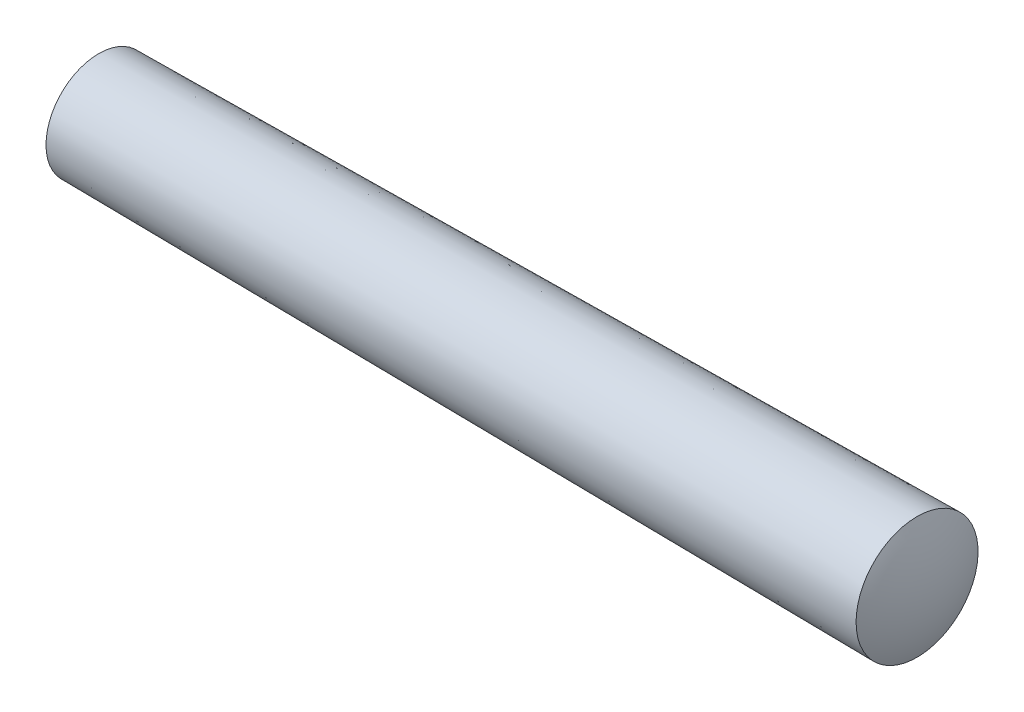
SolidWorks part; units mm, degrees
ref_plane "Plane1" through (0, 0, 0) normal (0, 0, 1) x (1, 0, 0)
ref_plane "Plane2" through (0, 0, 0) normal (0, 1, 0) x (1, 0, 0)
ref_plane "Plane3" through (0, 0, 0) normal (1, 0, 0) x (0, 0, -1)
sketch "BodySke" plane through (0, 0, 0) normal (0, 0, 1) x (1, 0, 0)
  line L0 (0, 0) -> (210, 0) construction
  line L2 (0.63, 2.5) -> (39.37, 2.8874)
  line L4 (0, 0) -> (40, 0)
  line L5 (0.63, -2.5) -> (39.37, -2.8874) construction
  arc A0 (0.63, 2.5) -> (0, 0) centre (5.2753, 0) ccw
  arc A1 (39.37, 2.8874) -> (40, 0) centre (33.0683, 0) cw
  dimension "D1" = 0.63
  dimension "Diameter" = 5
  dimension "D2" = 0.573
  dimension "Length" = 40
  dimension "Crown_ht" = 0.63
revolve "Body" add sketch "BodySke" angle 360 about L0
equation "\"D1@BodySke\" = \"Crown_ht@BodySke\""
